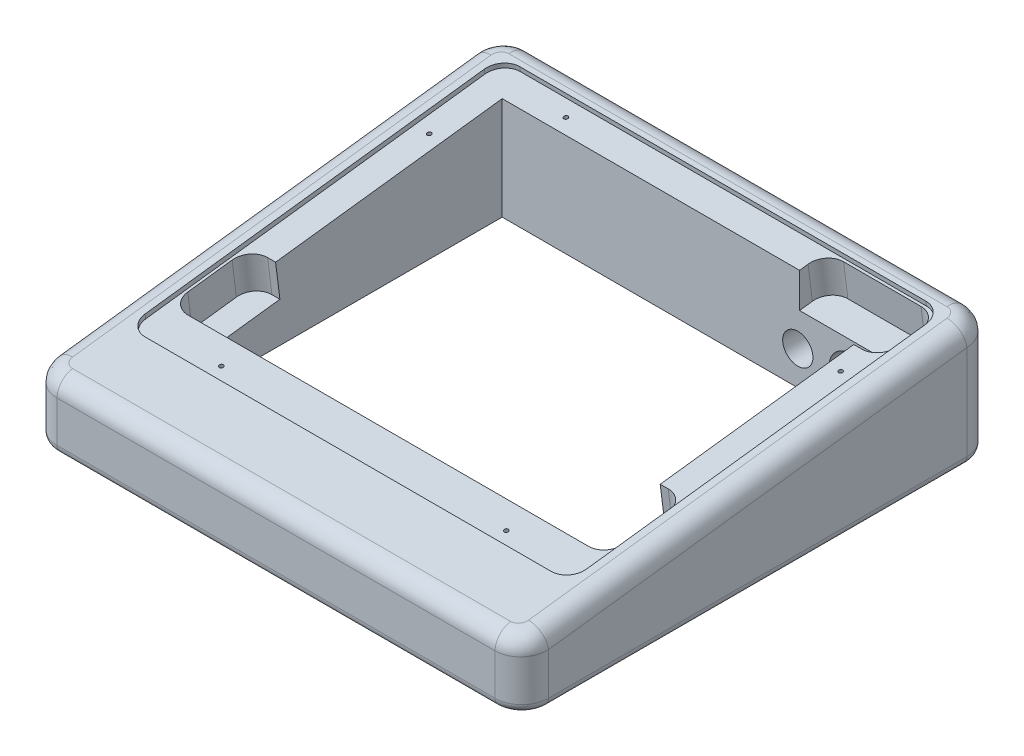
SolidWorks part; units mm, degrees
ref_plane "Alzado" through (0, 0, 0) normal (0, 0, 1) x (1, 0, 0)
ref_plane "Planta" through (0, 0, 0) normal (0, 1, 0) x (1, 0, 0)
ref_plane "Vista lateral" through (0, 0, 0) normal (1, 0, 0) x (0, 0, -1)
sketch "Croquis1" plane through (0, 0, 0) normal (0, 1, 0) x (1, 0, 0)
  line L1 (-138, -117.5) -> (138, -117.5)
  line L2 (-138, -117.5) -> (-138, 117.5)
  line L3 (-138, 117.5) -> (138, 117.5)
  line L4 (138, -117.5) -> (138, 117.5)
  line L5 (-138, -117.5) -> (138, 117.5) construction
  line L6 (-138, 117.5) -> (138, -117.5) construction
  point P0 (0, 0)
  dimension "D1" = 276
  dimension "D2" = 235
extrude "Saliente-Extruir1" add sketch "Croquis1" along normal blind 70
fillet "Redondeo1" radius 15 2 edges at (-138, 35, -117.5) (138, 35, -117.5)
sketch "Croquis3" plane through (0, 0, 0) normal (1, 0, 0) x (0, 0, -1)
  line L0 (-117.5, 40.6251) -> (117.5, 70)
  line L1 (117.5, 70) -> (117.5, 134.5145)
  line L2 (117.5, 134.5145) -> (-117.5, 134.5145)
  line L3 (-117.5, 134.5145) -> (-117.5, 40.6251)
  line L4 (-117.5, 70) -> (-117.5, 0) construction
  line L5 (55, 0) -> (-55, 0) construction
  line L6 (117.5, 70) -> (117.5, 0) construction
  dimension "D1" = 7.125
extrude "Cortar-Extruir2" cut sketch "Croquis3" against normal through all both and the other way through all
sketch "Croquis4" plane through (0, 0, 0) normal (0, 1, 0) x (1, 0, 0)
  line L0 (-138, 102.5) -> (-138, -117.5) construction
  line L1 (-138, -117.5) -> (138, -117.5) construction
  line L2 (138, -117.5) -> (138, 102.5) construction
  line L3 (123, 117.5) -> (-123, 117.5) construction
  line L50 (-108, 87.5) -> (-108, -84.5)
  line L51 (-108, -84.5) -> (108, -84.5)
  line L52 (108, -84.5) -> (108, 87.5)
  line L53 (108, 87.5) -> (-108, 87.5)
  dimension "D2" = 33
  dimension "D1" = 30
  dimension "D3" = 30
  dimension "D4" = 30
extrude "Cortar-Extruir4" cut sketch "Croquis4" against normal blind 64 and the other way through all
sketch "Croquis8" plane through (0, 0, 0) normal (0, -1, 0) x (1, 0, 0)
  line L0 (108, 84.5) -> (108, -87.5) construction
  line L1 (-108, 84.5) -> (108, 84.5) construction
  line L2 (-108, -87.5) -> (-108, 84.5) construction
  line L3 (108, -87.5) -> (-108, -87.5) construction
  line L20 (-104, 100.5) -> (104, 100.5)
  line L21 (124, 80.5) -> (124, -83.5)
  line L22 (104, -103.5) -> (-104, -103.5)
  line L23 (-124, -83.5) -> (-124, 80.5)
  line L28 (124, -103.5) -> (124, 100.5) construction
  line L29 (-124, -103.5) -> (124, -103.5) construction
  line L30 (124, 100.5) -> (-124, 100.5) construction
  line L31 (-124, 100.5) -> (-124, -103.5) construction
  arc A8 (-104, 100.5) -> (-124, 80.5) centre (-104, 80.5) ccw
  arc A9 (124, 80.5) -> (104, 100.5) centre (104, 80.5) ccw
  arc A10 (104, -103.5) -> (124, -83.5) centre (104, -83.5) ccw
  arc A11 (-124, -83.5) -> (-104, -103.5) centre (-104, -83.5) ccw
  dimension "D2" = 40
  dimension "D3" = 16
  dimension "D1" = 16
  dimension "D4" = 16
  dimension "D5" = 16
extrude "Cortar-Extruir8" cut sketch "Croquis8" against normal blind 6
sketch "Croquis11" plane through (0, 54.4616, 6.8077) normal (0, 0.9923, 0.124) x (1, 0, 0)
  line L0 (108, -78.2969) -> (108, 95.0416) construction
  line L1 (108, 95.0416) -> (-108, 95.0416) construction
  line L3 (-108, 95.0416) -> (-108, -78.2969) construction
  line L12 (-114, -100.9584) -> (114, -100.9584)
  line L13 (124, -90.9584) -> (124, 101.0416)
  line L14 (114, 111.0416) -> (-114, 111.0416)
  line L15 (-124, 101.0416) -> (-124, -90.9584)
  arc A4 (-124, -90.9584) -> (-114, -100.9584) centre (-114, -90.9584) ccw
  arc A5 (-114, 111.0416) -> (-124, 101.0416) centre (-114, 101.0416) ccw
  arc A6 (124, 101.0416) -> (114, 111.0416) centre (114, 101.0416) ccw
  arc A7 (114, -100.9584) -> (124, -90.9584) centre (114, -90.9584) ccw
  dimension "D2" = 20
  dimension "D1" = 16
  dimension "D3" = 16
  dimension "D4" = 212
  dimension "D5" = 16
extrude "Cortar-Extruir10" cut sketch "Croquis11" against normal blind 2.6
sketch "Croquis15" plane through (-138, 0, 0) normal (-1, 0, 0) x (0, 0, 1)
  line L1 (147.5, 0) -> (117.5, 0)
  line L2 (117.5, 40.6251) -> (117.5, 0)
  line L3 (117.5, 40.6251) -> (147.5, 36.8751)
  line L4 (147.5, 36.8751) -> (147.5, 0)
  line L5 (-117.5, 0) -> (-117.5, 70) construction
  line L6 (117.5, 40.6251) -> (-102.5, 68.125) construction
  dimension "D1" = 265
extrude "Saliente-Extruir2" add sketch "Croquis15" against normal up to surface (276 mm away)
fillet "Redondeo9" radius 15 2 edges at (138, 18.4375, 147.5) (-138, 18.4375, 147.5)
fillet "Redondeo7" radius 5 8 edges at (138, 0, 15) (133.6066, 0, -113.1066) (0, 0, -117.5) (-133.6066, 0, -113.1066) (-138, 0, 15) (0, 0, 147.5) (133.6066, 0, 143.1066) (-133.6066, 0, 143.1066)
fillet "Redondeo8" radius 10 8 edges at (-133.6066, 69.4508, -113.1066) (0, 70, -117.5) (133.6066, 69.4508, -113.1066) (138, 53.4375, 15) (0, 36.8751, 147.5) (-138, 53.4375, 15) (-133.6066, 37.4243, 143.1066) (133.6066, 37.4243, 143.1066)
sketch "Croquis19" plane through (0, 0, -117.5) normal (0, 0, -1) x (-1, 0, 0)
  line L0 (-138, 5) -> (-138, 58.0472) construction
  line L1 (129.25, 0) -> (-129.25, 0) construction
  circle A0 centre (-88, 25) radius 12.5
  dimension "D1" = 25
  dimension "D2" = 50
  dimension "D3" = 25
extrude "Cortar-Extruir17" cut sketch "Croquis19" against normal up to next
sketch "Croquis22" plane through (0, 0, -117.5) normal (0, 0, -1) x (-1, 0, 0)
  line L1 (-101.5, 9) -> (-74.5, 9)
  line L2 (-101.5, 9) -> (-101.5, 41)
  line L3 (-101.5, 41) -> (-74.5, 41)
  line L4 (-74.5, 9) -> (-74.5, 41)
  line L5 (-101.5, 9) -> (-74.5, 41) construction
  line L6 (-101.5, 41) -> (-74.5, 9) construction
  point P0 (-88, 25)
  dimension "D1" = 27
  dimension "D2" = 32
extrude "Cortar-Extruir20" cut sketch "Croquis22" against normal blind 5
fillet "Redondeo10" radius 5 4 edges at (74.5, 41, -115) (101.5, 41, -115) (101.5, 9, -115) (74.5, 9, -115)
sketch "Croquis21" plane through (0, 0, -117.5) normal (0, 0, -1) x (-1, 0, 0)
  line L0 (-88, 25) -> (-58, 25) construction
  circle A0 centre (-58, 25) radius 8.5
  dimension "D1" = 17
  dimension "D2" = 30
extrude "Conector alimentación DC" cut sketch "Croquis21" against normal up to next
sketch "Croquis23" plane through (0, 54.2135, 8.7922) normal (0, 0.9923, 0.124) x (1, 0, 0)
  line L0 (-122.5, -31.5314) -> (-61, -31.5314)
  line L1 (-124, 103.0416) -> (-124, -88.9584) construction
  line L2 (59, 76.0416) -> (59, 111.5416)
  line L3 (124, -88.9584) -> (124, 103.0416) construction
  line L5 (124, 102.0416) -> (124, 78.0416) construction
  line L6 (124, -88.9584) -> (124, 103.0416) construction
  line L7 (122.5, 78.0416) -> (82.7506, 78.0416)
  line L8 (82.7506, 78.0416) -> (82.7506, -31.5314)
  line L9 (82.7506, -31.5314) -> (122.5, -31.5314)
  line L10 (124, -31.5314) -> (124, -74.5314) construction
  line L12 (122.5, -76.6219) -> (-122.5, -76.6219)
  line L13 (59, 111.5416) -> (112.5, 111.5416)
  line L14 (-124, -74.5314) -> (-124, -31.5314) construction
  line L15 (-61, -31.5314) -> (-61, 76.0416)
  line L16 (-61, 76.0416) -> (59, 76.0416)
  line L17 (-108, -76.6219) -> (108, -76.6219) construction
  line L18 (-122.5, -31.5314) -> (-122.5, -76.6219)
  line L20 (122.5, -31.5314) -> (122.5, -76.6219)
  line L21 (122.5, 78.0416) -> (122.5, 101.5416)
  line L22 (114, 113.0416) -> (-114, 113.0416) construction
  arc A0 (122.5, 101.5416) -> (112.5, 111.5416) centre (112.5, 101.5416) ccw
  dimension "D5" = 10
  dimension "D1" = 65
  dimension "D2" = 43
  dimension "D3" = 1.5
  dimension "D4" = 120
  dimension "D8" = 1.5
  dimension "D9" = 1.5
extrude "Rebajes anclaje PCB" cut sketch "Croquis23" against normal blind 22
fillet "Redondeo4" [suppressed] radius 6
ref_plane "Plano1" through (108, 44.0788, -87.5) normal (-1, 0, 0) x (0, 0, 1)
fillet "Redondeo11" radius 10 6 edges at (59, 55.8435, -103.4137) (-122.5, 38.0975, 38.5545) (-122.5, 32.5047, 83.2969) (122.5, 38.0975, 38.5545) (122.5, 32.5047, 83.2969) (122.5, 51.6883, -70.1723)
sketch "Croquis27" plane through (0, 0, -117.5) normal (0, 0, -1) x (-1, 0, 0)
  line L0 (-88, 25) -> (-58, 25) construction
  line L1 (-113.5, 5.5) -> (-33.5, 5.5)
  line L2 (-113.5, 5.5) -> (-113.5, 44.5)
  line L3 (-113.5, 44.5) -> (-33.5, 44.5)
  line L4 (-33.5, 5.5) -> (-33.5, 44.5)
  line L5 (-113.5, 5.5) -> (-33.5, 44.5) construction
  line L6 (-113.5, 44.5) -> (-33.5, 5.5) construction
  circle A2 centre (-88, 25) radius 12.5 construction
  point P0 (-73.5, 25)
  dimension "D1" = 80
  dimension "D2" = 39
  dimension "D3" = 25.5
extrude "Cortar-Extruir24" cut sketch "Croquis27" against normal blind 2.5
fillet "Redondeo12" radius 5 4 edges at (33.5, 44.5, -116.25) (33.5, 5.5, -116.25) (113.5, 5.5, -116.25) (113.5, 44.5, -116.25)
sketch "Croquis30" plane through (0, 6, 0) normal (0, -1, 0) x (-1, 0, 0)
  line L2 (-115, 93.5) -> (115, 93.5) construction
  line L3 (-115, 93.5) -> (-115, -90.5) construction
  line L4 (-115, -90.5) -> (115, -90.5) construction
  line L5 (115, 93.5) -> (115, -90.5) construction
  line L9 (-100, 93.5) -> (-100, -90.5) construction
  line L10 (100, 93.5) -> (100, -90.5) construction
  line L11 (-115, -73.5) -> (115, -73.5) construction
  line L12 (-115, 76.5) -> (115, 76.5) construction
  circle A0 centre (-100, 93.5) radius 1.15 construction
  circle A1 centre (100, 93.5) radius 1.15 construction
  circle A2 centre (-100, -90.5) radius 1.15 construction
  circle A3 centre (100, -90.5) radius 1.15 construction
  circle A4 centre (-115, 76.5) radius 1.15
  circle A5 centre (-115, -73.5) radius 1.15
  circle A6 centre (115, -73.5) radius 1.15
  circle A7 centre (115, 76.5) radius 1.15
  point P5 (0, -73.5)
  dimension "D1" = 200
  dimension "D3" = 2.3
  dimension "D8" = 150
  dimension "D2" = 100
  dimension "D4" = 184
  dimension "D5" = 230
  dimension "D6" = 17
  dimension "D7" = 90.5
extrude "Cortar-Extruir26" cut sketch "Croquis30" against normal blind 8
sketch "Croquis28" plane through (0, 0, -115) normal (0, 0, -1) x (-1, 0, 0)
  line L0 (-108, 11) -> (-108, 39) construction
  line L1 (-113.5, 39.5) -> (-113.5, 10.5) construction
  line L2 (-108, 25) -> (-39, 25) construction
  line L3 (-39, 25) -> (-39, 11) construction
  line L4 (-38.5, 44.5) -> (-108.5, 44.5) construction
  circle A0 centre (-108, 39) radius 1.15
  circle A1 centre (-108, 11) radius 1.15
  circle A2 centre (-39, 11) radius 1.15
  circle A3 centre (-39, 39) radius 1.15
  point P8 (-113.5, 25)
  point P12 (-108, 25)
  point P15 (-73.5, 44.5)
  point P16 (-73.5, 25)
  dimension "D1" = 2.3
  dimension "D2" = 28
  dimension "D3" = 69
extrude "Cortar-Extruir25" cut sketch "Croquis28" against normal blind 8
sketch "Croquis25" plane through (0, 51.8817, 6.4852) normal (0, 0.9923, 0.124) x (1, 0, 0)
  line L0 (124, -90.9584) -> (124, 101.0416) construction
  line L2 (114, 111.0416) -> (-114, 111.0416) construction
  line L3 (114, 111.0416) -> (-114, 111.0416) construction
  line L18 (-2.0027, 187.0182) -> (-2.0027, -244.8521) construction
  circle A1 centre (-80, 102.5416) radius 1.15
  circle A10 centre (115.5, 61.0416) radius 1.15
  circle A12 centre (-115.5, 61.0416) radius 1.15
  circle A22 centre (-80, -92.4584) radius 1.15
  circle A23 centre (80, -92.4584) radius 1.15
  point P23 (-2.0027, 129.3649)
  point P29 (-1.54, 118.1957)
  point P54 (-2.0027, 129.3649)
  dimension "D1" = 2.3
  dimension "D3" = 8.5
  dimension "D7" = 44
  dimension "D8" = 239.5
  dimension "D4" = 203.5
  dimension "D5" = 8.5
  dimension "D6" = 50
  dimension "D2" = 204
extrude "Cortar-Extruir22" cut sketch "Croquis25" against normal blind 8
sketch "Croquis26" plane through (0, 32.6315, 4.0789) normal (0, 0.9923, 0.124) x (1, 0, 0)
  line L0 (124, -90.9584) -> (124, 101.0416) construction
  line L3 (-124, 101.0416) -> (-124, -90.9584) construction
  line L4 (112.5, -33.5314) -> (108, -33.5314) construction
  line L5 (-108, -33.5314) -> (-112.5, -33.5314) construction
  line L7 (124, -90.9584) -> (124, 101.0416) construction
  line L8 (114, 111.0416) -> (-114, 111.0416) construction
  circle A0 centre (-115.5, -63.5314) radius 1.15
  circle A1 centre (115.5, -53.5314) radius 1.15
  circle A2 centre (115.5, 102.5416) radius 1.15 construction
  circle A3 centre (73.29, 102.5416) radius 1.15
  dimension "D1" = 2.3
  dimension "D6" = 30
  dimension "D7" = 8.5
  dimension "D2" = 8.5
  dimension "D3" = 8.5
  dimension "D4" = 8.5
  dimension "D5" = 20
  dimension "D8" = 42.21
extrude "Cortar-Extruir23" [suppressed] cut sketch "Croquis26" against normal blind 10
sketch "Croquis31" plane through (0, 6, 0) normal (0, -1, 0) x (1, 0, 0)
  line L0 (124, -83.5) -> (124, 80.5) construction
  line L1 (124, 50.5) -> (73.3852, 50.5)
  line L2 (124, 50.5) -> (124, -34.5)
  line L3 (124, -34.5) -> (73.3852, -34.5)
  line L4 (73.3852, 50.5) -> (73.3852, -34.5)
  line L5 (104, 100.5) -> (-104, 100.5) construction
  dimension "D1" = 85
  dimension "D2" = 50
extrude "Cortar-Extruir27" cut sketch "Croquis31" against normal blind 17
fillet "Redondeo13" radius 10 2 edges at (124, 14.5, -34.5) (124, 14.5, 50.5)
sketch "Croquis32" plane through (0, 0, 0) normal (0, -1, 0) x (1, 0, 0)
  line L0 (0, 132.5) -> (0, -102.5) construction
  line L1 (-123, 132.5) -> (123, 132.5) construction
  line L2 (-123, 132.5) -> (-123, -102.5) construction
  line L3 (-123, -102.5) -> (123, -102.5) construction
  line L4 (123, 132.5) -> (123, -102.5) construction
  circle A0 centre (-123, 132.5) radius 4.5
  circle A1 centre (123, 132.5) radius 4.5
  circle A2 centre (123, -102.5) radius 4.5
  circle A3 centre (-123, -102.5) radius 4.5
  arc A4 (-133, -102.5) -> (-123, -112.5) centre (-123, -102.5) ccw construction
  arc A5 (123, -112.5) -> (133, -102.5) centre (123, -102.5) ccw construction
  arc A6 (-123, 142.5) -> (-133, 132.5) centre (-123, 132.5) ccw construction
  dimension "D1" = 9
extrude "Cortar-Extruir28" cut sketch "Croquis32" against normal blind 0.5
sketch "Croquis33" plane through (0, 0, -112.5) normal (0, 0, -1) x (-1, 0, 0)
  line L0 (-88, 37.5) -> (-88, 12.5) construction
  line L1 (-100.5, 25) -> (-75.5, 25) construction
  circle A0 centre (-78.5, 13) radius 1.15
  circle A1 centre (-88, 25) radius 12.5 construction
  circle A2 centre (-88, 25) radius 12.5 construction
  dimension "D3" = 2.3
  dimension "D1" = 12
  dimension "D2" = 9.5
extrude "Cortar-Extruir29" cut sketch "Croquis33" against normal blind 8
